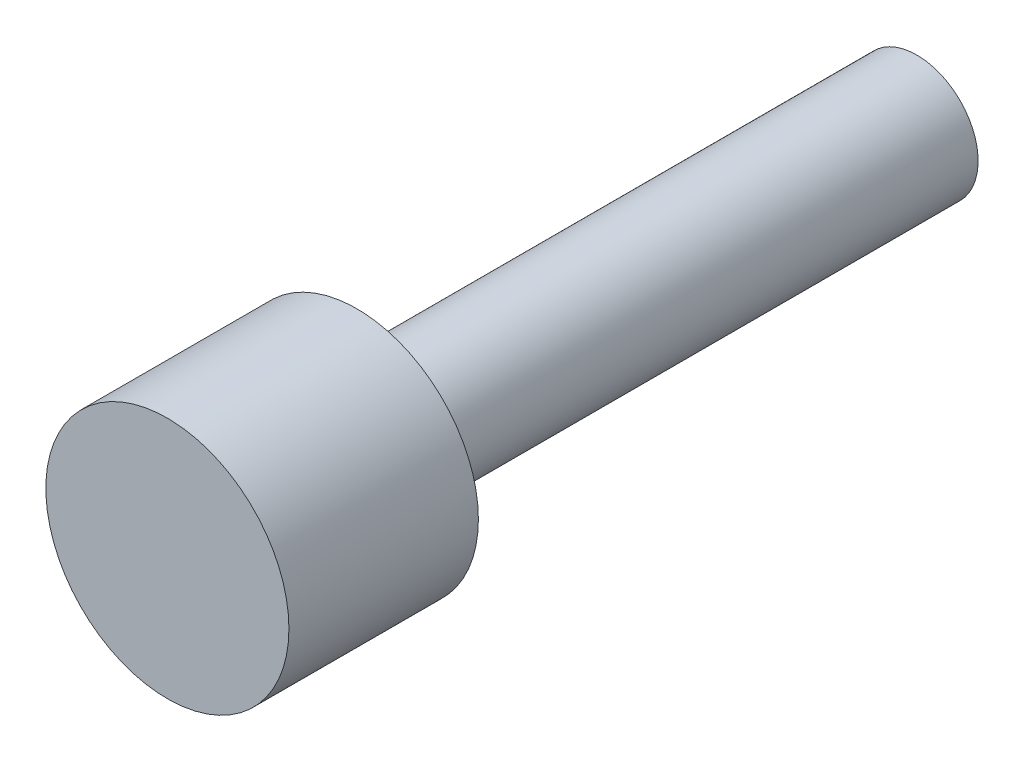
SolidWorks part; units mm, degrees
ref_plane "Front Plane" through (0, 0, 0) normal (0, 0, 1) x (1, 0, 0)
ref_plane "Top Plane" through (0, 0, 0) normal (0, 1, 0) x (1, 0, 0)
ref_plane "Right Plane" through (0, 0, 0) normal (1, 0, 0) x (0, 0, -1)
sketch "Sketch1" plane through (0, 0, 0) normal (0, 0, 1) x (1, 0, 0)
  circle A0 centre (0, 0) radius 7.1438
extrude "Boss-Extrude1" add sketch "Sketch1" against normal up to surface (11.1347 mm away)
sketch "Sketch2" plane through (0, 0, -11.1347) normal (0, 0, -1) x (-1, 0, 0)
  circle A0 centre (0, 0) radius 3.5954
  dimension "D1" = 7.1907
extrude "Boss-Extrude2" add sketch "Sketch2" along normal up to surface (32.9184 mm away)
